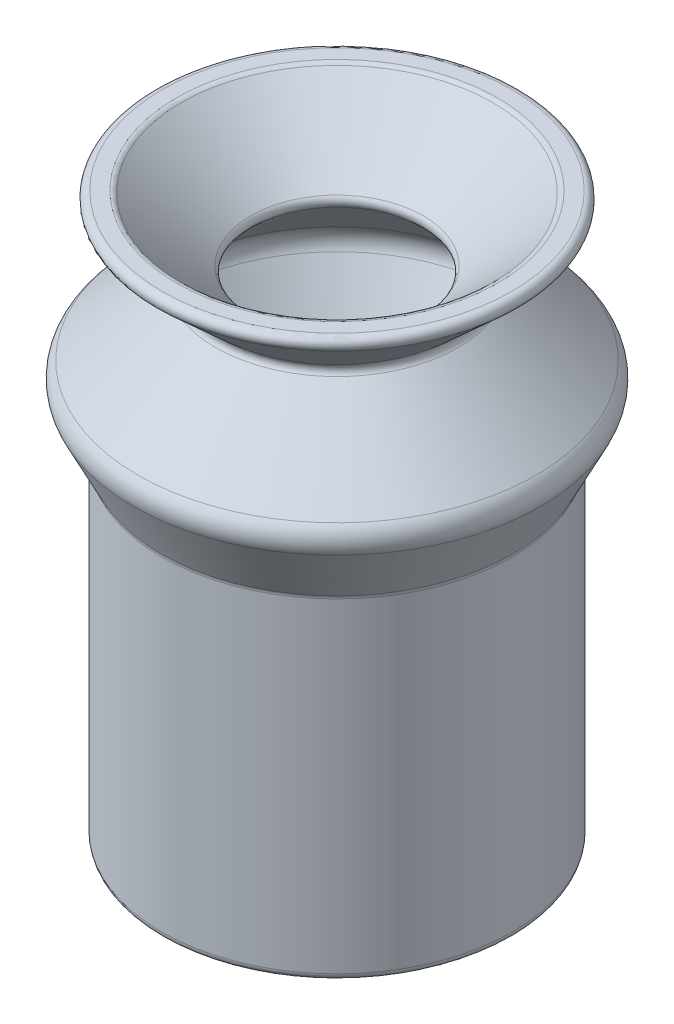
SolidWorks part; units mm, degrees
ref_plane "前视基准面" through (0, 0, 0) normal (0, 0, 1) x (1, 0, 0)
ref_plane "上视基准面" through (0, 0, 0) normal (0, 1, 0) x (1, 0, 0)
ref_plane "右视基准面" through (0, 0, 0) normal (1, 0, 0) x (0, 0, -1)
sketch "草图1" plane through (0, 0, 0) normal (0, 1, 0) x (1, 0, 0)
  circle A0 centre (0, 0) radius 5
  dimension "D1" = 10
extrude "凸台-拉伸1" add sketch "草图1" along normal blind 9.5
sketch "草图2" plane through (0, 0, 0) normal (1, 0, 0) x (0, 0, -1)
  line L0 (0, 9.5) -> (-5, 9.5)
  line L1 (5, 9.5) -> (-5, 9.5) construction
  line L2 (-5, 9.5) -> (-6, 11.5)
  line L3 (-6, 11.5) -> (-3.3, 14)
  line L4 (-3.3, 14) -> (-5.5, 16)
  line L5 (-5.5, 16) -> (0, 16)
  line L6 (0, 16) -> (0, 9.5)
  dimension "D1" = 6
  dimension "D2" = 2
  dimension "D3" = 3.3
  dimension "D4" = 4.5
  dimension "D5" = 6.5
  dimension "D6" = 5.5
revolve "旋转1" add sketch "草图2" angle 360 about L6
sketch "草图3" plane through (0, 0, 0) normal (1, 0, 0) x (0, 0, -1)
  line L0 (0, 9.5) -> (-4, 9.5)
  line L1 (-5, 9.5) -> (5, 9.5) construction
  line L2 (-4, 9.5) -> (-5, 11.5)
  line L3 (-6, 11.5) -> (6, 11.5) construction
  line L4 (-5, 11.5) -> (-2.3, 14)
  line L5 (-3.3, 14) -> (3.3, 14) construction
  line L6 (-2.3, 14) -> (-4.5, 16)
  line L7 (5.5, 16) -> (-5.5, 16) construction
  line L8 (-4.5, 16) -> (0, 16)
  line L9 (0, 16) -> (0, 9.5)
  dimension "D1" = 1
  dimension "D2" = 1
  dimension "D3" = 1
  dimension "D4" = 1
revolve "切除-旋转1" cut sketch "草图3" angle 360 about L9
sketch "草图4" plane through (0, 0, 0) normal (0, -1, 0) x (1, 0, 0)
  circle A0 centre (0, 0) radius 2.3
  dimension "D1" = 4.6
extrude "切除-拉伸1" cut sketch "草图4" against normal blind 9.5
fillet "圆角1" radius 0.2 9 edges at (0, 9.5, -2.3) (0, 9.5, 4) (0, 14, 2.3) (0, 16, 4.5) (0, 16, 5.5) (0, 14, 3.3) (0, 9.5, 5) (0, 0, -2.3) (0, 0, 5)
fillet "圆角2" radius 0.6 2 edges at (0, 11.5, 5) (0, 11.5, 6)
